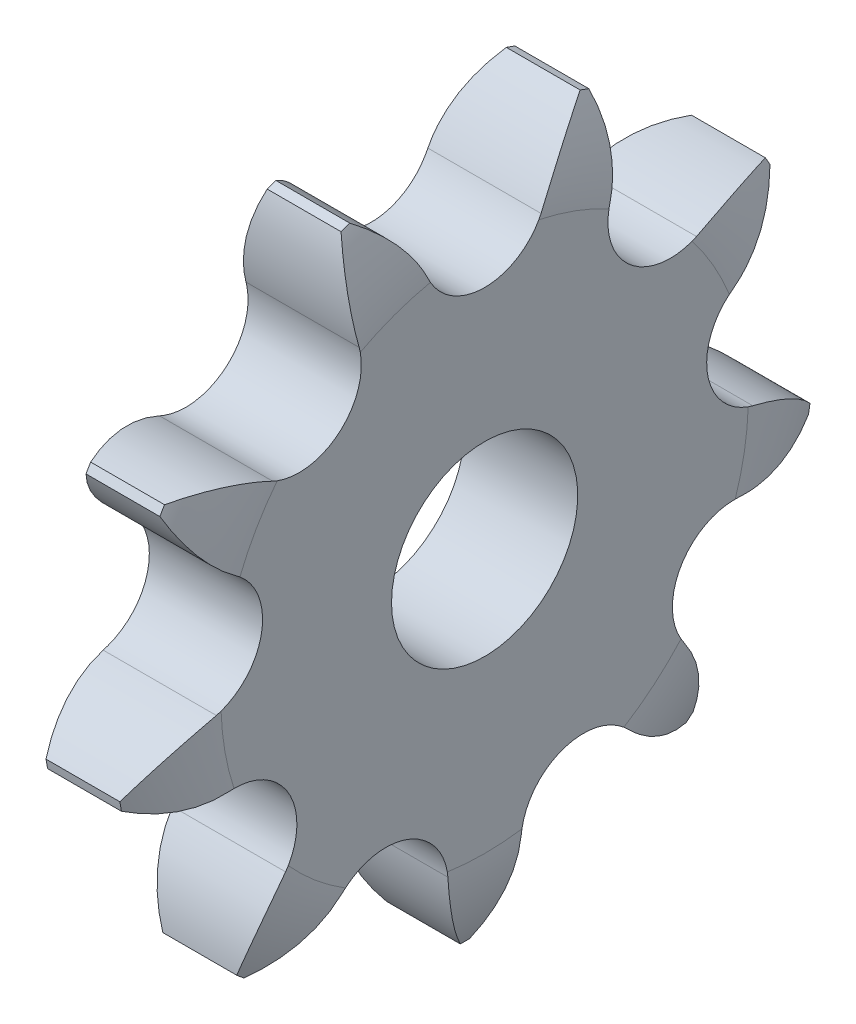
SolidWorks part; units mm, degrees
ref_plane "Plane1" through (0, 0, 0) normal (0, 0, 1) x (1, 0, 0)
ref_plane "Plane2" through (0, 0, 0) normal (0, 1, 0) x (1, 0, 0)
ref_plane "Plane3" through (0, 0, 0) normal (1, 0, 0) x (0, 0, -1)
sketch "Clipboard" plane through (0, 0, 0) normal (0, 1, 0) x (1, 0, 0)
  line L0 (0, 0) -> (12.5436, -1.9867)
  line L1 (-15, 0) -> (100, 0) construction
  line L2 (0, 0) -> (-0.8416, 0.9512)
  line L3 (0, 0) -> (-11.863, 4.5341)
  line L4 (0, 0) -> (3.0618, 0.4849)
  line L5 (0, 0) -> (-2.8109, -1.0484)
  line L6 (0, 0) -> (-6.0514, -4.0829)
  line L7 (-0.8416, 0.9512) -> (8.5146, 2.6009)
  line L8 (-76.2, 38.1) -> (-75.2, 38.1)
  line L9 (-73.4321, 41.7084) -> (-72.837, 41.7846)
  line L10 (-73.4741, 12.9512) -> (-59.0941, 12.9512)
  circle A0 centre (0, 0) radius 3.975
  circle A1 centre (0, 0) radius 10.0465
  circle A2 centre (0, 0) radius 25
  dimension "Dr" = 7.95
  dimension "MHD" = 20.093
  dimension "Hub_dia" = 50
  dimension "Num_teeth" = 9
  dimension "Pitch" = 12.7
  dimension "Width" = 3.1
  dimension "Side_relief" = 1.27
  dimension "Side_radius" = 12.7
  dimension "Overall_len" = 3
  dimension "Show_teeth" = 9
  dimension "Thickness" = 7.3
  dimension "OAL" = 9.5005
  dimension "T_dim" = 1
  dimension "Fillet_rad" = 0.6
  dimension "Face_width" = 7.3
  dimension "Num_strands" = 1
  dimension "Transv_pitch" = 14.38
  dimension "Plate_wid" = 12
sketch "BasProSke" plane through (0, 0, 0) normal (0, 1, 0) x (1, 0, 0)
  line L0 (-10, 0) -> (60, 0) construction
  line L1 (0, 0) -> (0, 16.9929)
  line L2 (0, 0) -> (7.3, 0)
  line L3 (7.3, 0) -> (7.3, 16.9929)
  line L4 (6.03, 22.5287) -> (1.27, 22.5287)
  arc A0 (0, 16.9929) -> (1.27, 22.5287) centre (12.7, 16.9929) cw
  arc A1 (7.3, 16.9929) -> (6.03, 22.5287) centre (-5.4, 16.9929) ccw
  dimension "D1" = 12.7
  dimension "G1" = 1.27
  dimension "G2" = 1.27
  dimension "Diameter" = 45.0573
  dimension "Thickness" = 7.3
revolve "Base-Revolve" add sketch "BasProSke" angle 360 about L0
sketch "TooCutSke" plane through (0, 0, 0) normal (1, 0, 0) x (0, 0, -1)
  line L0 (0, 18.6059) -> (3.6386, 16.9092) construction
  line L1 (0, 0) -> (0, 107) construction
  line L2 (0, 18.6059) -> (-10, 18.6059) construction
  line L3 (0, 18.6059) -> (-3.6386, 16.9092) construction
  arc A0 (3.6386, 16.9092) -> (7.9748, 21.6037) centre (13.1494, 12.4742) cw
  arc A1 (3.6386, 16.9092) -> (-3.6386, 16.9092) centre (0, 18.6059) cw
  arc A2 (-3.6386, 16.9092) -> (-7.9748, 21.6037) centre (-13.1494, 12.4742) ccw
  arc A3 (7.9748, 21.6037) -> (-7.9748, 21.6037) centre (0, 0) ccw
  dimension "R1" = 4.0148
  dimension "R2" = 10.494
  dimension "Overcut" = 23.0287
  dimension "Seat_radius" = 18.6059
  dimension "X" = 130
extrude "ToothCut" cut sketch "TooCutSke" along normal through all
pattern_circular "TeethCuts" count 9 every 40 about axis through (-10, 0, 0) along (1, 0, 0) of "ToothCut"
sketch "HubNeaOneSke" plane through (0, 0, 0) normal (-1, 0, 0) x (0, 0, 1)
  circle A0 centre (0, 0) radius 10.0465
  dimension "Diameter" = 20.093
extrude "HubNearOne" [suppressed] add sketch "HubNeaOneSke" along normal blind 2.2005
fillet "HubNearOneFillet" [suppressed] radius 0.6
sketch "HubNeaBotSke" plane through (0, 0, 0) normal (-1, 0, 0) x (0, 0, 1)
  circle A0 centre (0, 0) radius 10.0465
  dimension "Diameter" = 20.093
extrude "HubNearBoth" [suppressed] add sketch "HubNeaBotSke" along normal blind 1.1003
fillet "HubNearBothFillet" [suppressed] radius 0.6
ref_plane "FarPln" through (7.3, 0, 0) normal (1, 0, 0) x (0, 0, -1)
sketch "HubFarSke" plane through (7.3, 0, 0) normal (1, 0, 0) x (0, 0, -1)
  circle A0 centre (0, 0) radius 10.0465
  dimension "Diameter" = 20.093
extrude "HubFar" [suppressed] add sketch "HubFarSke" along normal blind 1.1003
fillet "HubFarFillet" [suppressed] radius 0.6
sketch "BorSke" plane through (0, 0, 0) normal (1, 0, 0) x (0, 0, -1)
  circle A0 centre (0, 0) radius 6
  dimension "Diameter" = 12
extrude "Bore" cut sketch "BorSke" along normal mid plane 19.001
sketch "KeySke" plane through (0, 0, 0) normal (1, 0, 0) x (0, 0, -1)
  line L0 (-1, 0) -> (-1, 7)
  line L1 (-1, 7) -> (1, 7)
  line L2 (1, 7) -> (1, 0)
  line L3 (0, 0) -> (0, 34) construction
  line L4 (-1, 0) -> (1, 0)
  dimension "Offset" = 7
  dimension "Width" = 2
extrude "Keyway" [suppressed] cut sketch "KeySke" along normal mid plane 19.001
pattern_circular "Keyway2" [suppressed] count 2 every 90 about axis through (-10, 0, 0) along (1, 0, 0)
equation "' \"Pitch@Clipboard\" = 12.7"
equation "' \"Num_strands@Clipboard\" = 1"
equation "' \"Num_teeth@Clipboard\" = 9"
equation "' \"Hub_dia@Clipboard\" = 50"
equation "' \"Overall_len@Clipboard\" = 3"
equation "' \"Diameter@BorSke\" = 12"
equation "' \"T_dim@Clipboard\" = 1"
equation "' \"Width@KeySke\" = 2"
equation "' \"Dr@Clipboard\" = 7.95"
equation "' \"Face_width@Clipboard\" = 7.3"
equation "' \"Side_radius@Clipboard\" = 12.7"
equation "' \"Side_relief@Clipboard\" = 1.27"
equation "' \"Transv_pitch@Clipboard\" = 14.38"
equation "' \"Show_teeth@Clipboard\" = 9"
equation "' \"Fillet_rad@Clipboard\" = 0.6"
equation "' \"Plate_wid@Clipboard\" = 12"
equation "\"Num_teeth@Clipboard\" = int( \"Num_teeth@Clipboard\" )"
equation "\"Num_teeth@Clipboard\" = ((sgn( \"Num_teeth@Clipboard\" - 5.0)+1)*( \"Num_teeth@Clipboard\" - 5.0))/2 +5.0"
equation "\"Num_teeth@Clipboard\" = ((sgn( \"Num_teeth@Clipboard\" - 200.0)-1)*( \"Num_teeth@Clipboard\" - 200.0))/-2 +200.0"
equation "\"MHD@Clipboard\" = \"Pitch@Clipboard\" * (1.0 / tan(3.14159265 / \"Num_teeth@Clipboard\" )) - 1.05 * \"Plate_wid@Clipboard\" - 2.0 * \"Fillet_rad@Clipboard\" - 1.0"
equation "\"Thickness@Clipboard\"  = \"Face_width@Clipboard\" + (\"Num_strands@Clipboard\" - 1) * \"Transv_pitch@Clipboard\""
equation "\"OAL@Clipboard\" = \"Thickness@Clipboard\" + 2 * \"Fillet_rad@Clipboard\" + 1"
equation "\"MHD@Clipboard\" = ((sgn( \"MHD@Clipboard\" - \"Hub_dia@Clipboard\" )-1)*( \"MHD@Clipboard\" - \"Hub_dia@Clipboard\" ))/-2+ \"Hub_dia@Clipboard\""
equation "\"OAL@Clipboard\" = ((sgn( \"OAL@Clipboard\" - \"Overall_len@Clipboard\" )+1)*( \"OAL@Clipboard\" - \"Overall_len@Clipboard\" ))/2 + \"Overall_len@Clipboard\" + 0.0005"
equation "\"Num_teeth@TeethCuts\" = int( \"Show_teeth@Clipboard\" ) + 1"
equation "\"Num_teeth@TeethCuts\" = ((sgn( \"Num_teeth@TeethCuts\" - \"Num_teeth@Clipboard\" )-1)*( \"Num_teeth@TeethCuts\" - \"Num_teeth@Clipboard\" ))/-2+ \"Num_teeth@Clipboard\""
equation "\"Num_teeth@TeethCuts\" = ((sgn( \"Num_teeth@TeethCuts\" - 2.0)+1)*( \"Num_teeth@TeethCuts\" - 2.0))/2 +2.0"
equation "\"Angle@TeethCuts\" = 360.0 / \"Num_teeth@Clipboard\""
equation "\"Seat_radius@TooCutSke\" = ( \"Pitch@Clipboard\" / 2.0) / sin(3.14159265 / \"Num_teeth@Clipboard\" ) - \"Dr@Clipboard\" / 2.0 + \"Dr@Clipboard\" * 0.505"
equation "\"R1@TooCutSke\"  = \"Dr@Clipboard\" * 0.505"
equation "\"X@TooCutSke\" = 140.0 - (90.0 / \"Num_teeth@Clipboard\")"
equation "\"R2@TooCutSke\" = 0.12 * \"Dr@Clipboard\" * ( \"Num_teeth@Clipboard\" + 2.0)"
equation "\"Overcut@TooCutSke\" = 0.5 + 0.625 * \"Pitch@Clipboard\" - 0.5 * \"Dr@Clipboard\"  +  \"Pitch@Clipboard\" / 2.0 / sin(3.14159265 / \"Num_teeth@Clipboard\" )"
equation "\"Diameter@BasProSke\" = 2.0 * ( 0.625 * \"Pitch@Clipboard\" - 0.5 * \"Dr@Clipboard\"  +  \"Pitch@Clipboard\" / 2.0 / sin(3.14159265 / \"Num_teeth@Clipboard\" ))"
equation "\"Thickness@BasProSke\"  = \"Thickness@Clipboard\""
equation "\"G1@BasProSke\" =  \"Side_relief@Clipboard\""
equation "\"G2@BasProSke\" =  \"Side_relief@Clipboard\""
equation "\"D1@BasProSke\" =  \"Side_radius@Clipboard\""
equation "\"Diameter@HubNeaOneSke\" = \"MHD@Clipboard\""
equation "\"Length@HubNearOne\" = \"OAL@Clipboard\" - \"Thickness@BasProSke\""
equation "\"Diameter@HubNeaBotSke\" = \"MHD@Clipboard\""
equation "\"Length@HubNearBoth\" = ( \"OAL@Clipboard\" - \"Thickness@BasProSke\" ) / 2.0"
equation "\"D1@HubNearOneFillet\" = \"Fillet_rad@Clipboard\""
equation "\"D1@HubNearBothFillet\" = \"Fillet_rad@Clipboard\""
equation "\"Thickness@FarPln\" = \"Thickness@BasProSke\""
equation "\"Diameter@HubFarSke\" = \"MHD@Clipboard\""
equation "\"Length@HubFar\" = ( \"OAL@Clipboard\" - \"Thickness@BasProSke\" ) / 2.0"
equation "\"D1@HubFarFillet\" = \"Fillet_rad@Clipboard\""
equation "\"D1@Bore\" = \"OAL@Clipboard\" * 2.0"
equation "\"D1@Keyway\" = \"OAL@Clipboard\" * 2.0"
equation "\"Offset@KeySke\" = \"T_dim@Clipboard\" + \"Diameter@BorSke\" / 2.0"
